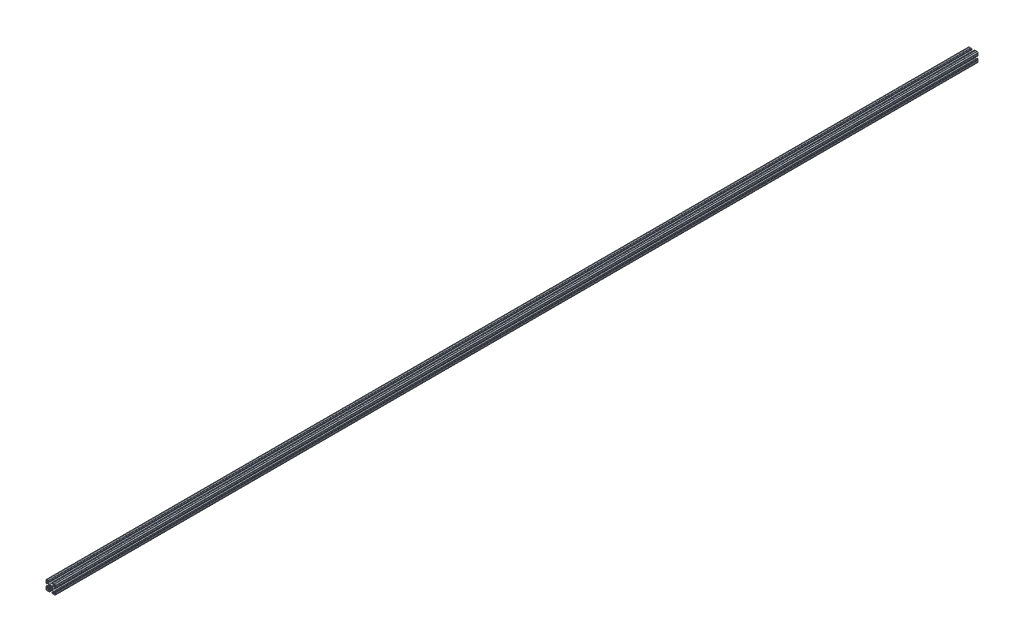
SolidWorks part; units mm, degrees
ref_plane "Front Plane" through (0, 0, 0) normal (0, 0, 1) x (1, 0, 0)
ref_plane "Top Plane" through (0, 0, 0) normal (0, 1, 0) x (1, 0, 0)
ref_plane "Right Plane" through (0, 0, 0) normal (1, 0, 0) x (0, 0, -1)
sketch "Sketch1" plane through (0, 0, 0) normal (0, 0, 1) x (1, 0, 0)
  line L0 (1.5823, 3.1988) -> (3.2921, 4.9085)
  line L1 (3.9207, 5.1689) -> (4.9149, 5.1689)
  line L2 (5.1689, 4.9149) -> (5.1689, 3.9207)
  line L3 (4.9085, 3.2921) -> (3.1988, 1.5823)
  line L4 (3.1988, -1.5823) -> (4.9085, -3.2921)
  line L5 (5.1689, -3.9207) -> (5.1689, -4.9149)
  line L6 (4.9149, -5.1689) -> (3.9207, -5.1689)
  line L7 (3.2921, -4.9085) -> (1.5823, -3.1988)
  line L8 (-1.5823, -3.1988) -> (-3.2921, -4.9085)
  line L9 (-3.9207, -5.1689) -> (-4.9149, -5.1689)
  line L10 (-5.1689, -4.9149) -> (-5.1689, -3.9207)
  line L11 (-4.9085, -3.2921) -> (-3.1988, -1.5823)
  line L12 (-3.1988, 1.5823) -> (-4.9085, 3.2921)
  line L13 (-5.1689, 3.9207) -> (-5.1689, 4.9149)
  line L14 (-4.9149, 5.1689) -> (-3.9207, 5.1689)
  line L15 (-3.2921, 4.9085) -> (-1.5823, 3.1988)
  line L16 (-11.8669, 14.0194) -> (-11.8669, 12.2479)
  line L17 (-12.2479, 11.8669) -> (-14.0195, 11.8669)
  line L18 (-14.0213, 11.8676) -> (-14.5575, 12.4039)
  line L19 (-14.5611, 12.4039) -> (-15.0973, 11.8676)
  line L20 (-15.0991, 11.8669) -> (-16.8707, 11.8669)
  line L21 (-17.2517, 12.2479) -> (-17.2517, 14.4577)
  line L22 (-14.4577, 17.2517) -> (-12.2479, 17.2517)
  line L23 (-11.8669, 16.8707) -> (-11.8669, 15.0991)
  line L24 (-11.8676, 15.0973) -> (-12.4039, 14.5611)
  line L25 (-12.4039, 14.5575) -> (-11.8676, 14.0212)
  line L26 (-14.0194, -11.8669) -> (-12.2479, -11.8669)
  line L27 (-11.8669, -12.2479) -> (-11.8669, -14.0195)
  line L28 (-11.8676, -14.0213) -> (-12.4039, -14.5575)
  line L29 (-12.4039, -14.5611) -> (-11.8676, -15.0973)
  line L30 (-11.8669, -15.0991) -> (-11.8669, -16.8707)
  line L31 (-12.2479, -17.2517) -> (-14.4577, -17.2517)
  line L32 (-17.2517, -14.4577) -> (-17.2517, -12.2479)
  line L33 (-16.8707, -11.8669) -> (-15.0991, -11.8669)
  line L34 (-15.0973, -11.8676) -> (-14.5611, -12.4039)
  line L35 (-14.5575, -12.4039) -> (-14.0212, -11.8676)
  line L36 (11.8669, -14.0194) -> (11.8669, -12.2479)
  line L37 (12.2479, -11.8669) -> (14.0195, -11.8669)
  line L38 (14.0213, -11.8676) -> (14.5575, -12.4039)
  line L39 (14.5611, -12.4039) -> (15.0973, -11.8676)
  line L40 (15.0991, -11.8669) -> (16.8707, -11.8669)
  line L41 (17.2517, -12.2479) -> (17.2517, -14.4577)
  line L42 (14.4577, -17.2517) -> (12.2479, -17.2517)
  line L43 (11.8669, -16.8707) -> (11.8669, -15.0991)
  line L44 (11.8676, -15.0973) -> (12.4039, -14.5611)
  line L45 (12.4039, -14.5575) -> (11.8676, -14.0212)
  line L46 (14.0194, 11.8669) -> (12.2479, 11.8669)
  line L47 (11.8669, 12.2479) -> (11.8669, 14.0195)
  line L48 (11.8676, 14.0213) -> (12.4039, 14.5575)
  line L49 (12.4039, 14.5611) -> (11.8676, 15.0973)
  line L50 (11.8669, 15.0991) -> (11.8669, 16.8707)
  line L51 (12.2479, 17.2517) -> (14.4577, 17.2517)
  line L52 (17.2517, 14.4577) -> (17.2517, 12.2479)
  line L53 (16.8707, 11.8669) -> (15.0991, 11.8669)
  line L54 (15.0973, 11.8676) -> (14.5611, 12.4039)
  line L55 (14.5575, 12.4039) -> (14.0212, 11.8676)
  line L56 (6.3498, -14.9848) -> (5.6531, -14.9848)
  line L57 (4.0778, -16.5601) -> (4.0778, -17.4747)
  line L58 (5.6531, -19.05) -> (7.9756, -19.05)
  line L59 (9.4996, -19.05) -> (14.2981, -19.05)
  line L60 (19.05, -14.3256) -> (19.05, -9.4996)
  line L61 (19.05, -7.9756) -> (19.05, -5.6531)
  line L62 (17.4747, -4.0778) -> (16.5601, -4.0778)
  line L63 (14.9848, -5.6531) -> (14.9848, -6.3498)
  line L64 (15.3661, -6.731) -> (15.6969, -6.731)
  line L65 (16.0782, -7.1122) -> (16.0782, -9.3968)
  line L66 (15.1881, -10.287) -> (12.3526, -10.2871)
  line L67 (11.4535, -9.9142) -> (7.1147, -5.5659)
  line L68 (6.7437, -4.6689) -> (6.7437, 4.6414)
  line L69 (7.1147, 5.5384) -> (11.481, 9.9142)
  line L70 (12.38, 10.2871) -> (15.1881, 10.287)
  line L71 (16.0782, 9.3968) -> (16.0782, 7.1122)
  line L72 (15.6969, 6.731) -> (15.3661, 6.731)
  line L73 (14.9848, 6.3498) -> (14.9848, 5.6531)
  line L74 (16.5601, 4.0778) -> (17.4747, 4.0778)
  line L75 (19.05, 5.6531) -> (19.05, 7.9756)
  line L76 (19.05, 9.4996) -> (19.05, 14.2981)
  line L77 (14.3256, 19.05) -> (9.4996, 19.05)
  line L78 (7.9756, 19.05) -> (5.6531, 19.05)
  line L79 (4.0778, 17.4747) -> (4.0778, 16.5601)
  line L80 (5.6531, 14.9848) -> (6.3498, 14.9848)
  line L81 (6.731, 15.3661) -> (6.731, 15.6969)
  line L82 (7.1122, 16.0782) -> (9.3968, 16.0782)
  line L83 (10.287, 15.1881) -> (10.2871, 12.3526)
  line L84 (9.9142, 11.4535) -> (5.5659, 7.1147)
  line L85 (4.6689, 6.7437) -> (-4.6414, 6.7437)
  line L86 (-5.5384, 7.1147) -> (-9.9142, 11.481)
  line L87 (-10.2871, 12.38) -> (-10.287, 15.1881)
  line L88 (-9.3968, 16.0782) -> (-7.1122, 16.0782)
  line L89 (-6.731, 15.6969) -> (-6.731, 15.3661)
  line L90 (-6.3498, 14.9848) -> (-5.6531, 14.9848)
  line L91 (-4.0778, 16.5601) -> (-4.0778, 17.4747)
  line L92 (-5.6531, 19.05) -> (-7.9756, 19.05)
  line L93 (-9.4996, 19.05) -> (-14.2981, 19.05)
  line L94 (-19.05, 14.3256) -> (-19.05, 9.4996)
  line L95 (-19.05, 7.9756) -> (-19.05, 5.6531)
  line L96 (-17.4747, 4.0778) -> (-16.5601, 4.0778)
  line L97 (-14.9848, 5.6531) -> (-14.9848, 6.3498)
  line L98 (-15.3661, 6.731) -> (-15.6969, 6.731)
  line L99 (-16.0782, 7.1122) -> (-16.0782, 9.3968)
  line L100 (-15.1881, 10.287) -> (-12.3526, 10.2871)
  line L101 (-11.4535, 9.9142) -> (-7.1147, 5.5659)
  line L102 (-6.7437, 4.6689) -> (-6.7437, -4.6414)
  line L103 (-7.1147, -5.5384) -> (-11.481, -9.9142)
  line L104 (-12.38, -10.2871) -> (-15.1881, -10.287)
  line L105 (-16.0782, -9.3968) -> (-16.0782, -7.1122)
  line L106 (-15.6969, -6.731) -> (-15.3661, -6.731)
  line L107 (-14.9848, -6.3498) -> (-14.9848, -5.6531)
  line L108 (-16.5601, -4.0778) -> (-17.4747, -4.0778)
  line L109 (-19.05, -5.6531) -> (-19.05, -7.9756)
  line L110 (-19.05, -9.4996) -> (-19.05, -14.2981)
  line L111 (-14.3256, -19.05) -> (-9.4996, -19.05)
  line L112 (-7.9756, -19.05) -> (-5.6531, -19.05)
  line L113 (-4.0778, -17.4747) -> (-4.0778, -16.5601)
  line L114 (-5.6531, -14.9848) -> (-6.3498, -14.9848)
  line L115 (-6.731, -15.3661) -> (-6.731, -15.6969)
  line L116 (-7.1122, -16.0782) -> (-9.3968, -16.0782)
  line L117 (-10.287, -15.1881) -> (-10.2871, -12.3526)
  line L118 (-9.9142, -11.4535) -> (-5.5659, -7.1147)
  line L119 (-4.6689, -6.7437) -> (4.6414, -6.7437)
  line L120 (5.5384, -7.1147) -> (9.9142, -11.481)
  line L121 (10.2871, -12.38) -> (10.287, -15.1881)
  line L122 (9.3968, -16.0782) -> (7.1122, -16.0782)
  line L123 (6.731, -15.6969) -> (6.731, -15.3661)
  arc A0 (1.178, 3.1119) -> (1.5823, 3.1988) centre (1.3129, 3.4682) ccw
  arc A1 (3.9207, 5.1689) -> (3.2921, 4.9085) centre (3.9207, 4.2799) ccw
  arc A2 (5.1689, 4.9149) -> (4.9149, 5.1689) centre (4.9149, 4.9149) ccw
  arc A3 (4.9085, 3.2921) -> (5.1689, 3.9207) centre (4.2799, 3.9207) ccw
  arc A4 (3.1988, 1.5823) -> (3.1119, 1.178) centre (3.4682, 1.3129) ccw
  arc A5 (3.1119, -1.178) -> (3.1119, 1.178) centre (0, 0) ccw
  arc A6 (3.1119, -1.178) -> (3.1988, -1.5823) centre (3.4682, -1.3129) ccw
  arc A7 (5.1689, -3.9207) -> (4.9085, -3.2921) centre (4.2799, -3.9207) ccw
  arc A8 (4.9149, -5.1689) -> (5.1689, -4.9149) centre (4.9149, -4.9149) ccw
  arc A9 (3.2921, -4.9085) -> (3.9207, -5.1689) centre (3.9207, -4.2799) ccw
  arc A10 (1.5823, -3.1988) -> (1.178, -3.1119) centre (1.3129, -3.4682) ccw
  arc A11 (-1.178, -3.1119) -> (1.178, -3.1119) centre (0, 0) ccw
  arc A12 (-1.178, -3.1119) -> (-1.5823, -3.1988) centre (-1.3129, -3.4682) ccw
  arc A13 (-3.9207, -5.1689) -> (-3.2921, -4.9085) centre (-3.9207, -4.2799) ccw
  arc A14 (-5.1689, -4.9149) -> (-4.9149, -5.1689) centre (-4.9149, -4.9149) ccw
  arc A15 (-4.9085, -3.2921) -> (-5.1689, -3.9207) centre (-4.2799, -3.9207) ccw
  arc A16 (-3.1988, -1.5823) -> (-3.1119, -1.178) centre (-3.4682, -1.3129) ccw
  arc A17 (-3.1119, 1.178) -> (-3.1119, -1.178) centre (0, 0) ccw
  arc A18 (-3.1119, 1.178) -> (-3.1988, 1.5823) centre (-3.4682, 1.3129) ccw
  arc A19 (-5.1689, 3.9207) -> (-4.9085, 3.2921) centre (-4.2799, 3.9207) ccw
  arc A20 (-4.9149, 5.1689) -> (-5.1689, 4.9149) centre (-4.9149, 4.9149) ccw
  arc A21 (-3.2921, 4.9085) -> (-3.9207, 5.1689) centre (-3.9207, 4.2799) ccw
  arc A22 (-1.5823, 3.1988) -> (-1.178, 3.1119) centre (-1.3129, 3.4682) ccw
  arc A23 (1.178, 3.1119) -> (-1.178, 3.1119) centre (0, 0) ccw
  arc A24 (-11.8669, 14.0194) -> (-11.8676, 14.0212) centre (-11.8694, 14.0194) ccw
  arc A25 (-12.2479, 11.8669) -> (-11.8669, 12.2479) centre (-12.2479, 12.2479) ccw
  arc A26 (-14.0213, 11.8676) -> (-14.0195, 11.8669) centre (-14.0195, 11.8694) ccw
  arc A27 (-14.5575, 12.4039) -> (-14.5611, 12.4039) centre (-14.5593, 12.4021) ccw
  arc A28 (-15.0991, 11.8669) -> (-15.0973, 11.8676) centre (-15.0991, 11.8694) ccw
  arc A29 (-17.2517, 12.2479) -> (-16.8707, 11.8669) centre (-16.8707, 12.2479) ccw
  arc A30 (-14.4577, 17.2517) -> (-17.2517, 14.4577) centre (-14.4577, 14.4577) ccw
  arc A31 (-11.8669, 16.8707) -> (-12.2479, 17.2517) centre (-12.2479, 16.8707) ccw
  arc A32 (-11.8676, 15.0973) -> (-11.8669, 15.0991) centre (-11.8694, 15.0991) ccw
  arc A33 (-12.4039, 14.5611) -> (-12.4039, 14.5575) centre (-12.4021, 14.5593) ccw
  arc A34 (-14.0194, -11.8669) -> (-14.0212, -11.8676) centre (-14.0194, -11.8694) ccw
  arc A35 (-11.8669, -12.2479) -> (-12.2479, -11.8669) centre (-12.2479, -12.2479) ccw
  arc A36 (-11.8676, -14.0213) -> (-11.8669, -14.0195) centre (-11.8694, -14.0195) ccw
  arc A37 (-12.4039, -14.5575) -> (-12.4039, -14.5611) centre (-12.4021, -14.5593) ccw
  arc A38 (-11.8669, -15.0991) -> (-11.8676, -15.0973) centre (-11.8694, -15.0991) ccw
  arc A39 (-12.2479, -17.2517) -> (-11.8669, -16.8707) centre (-12.2479, -16.8707) ccw
  arc A40 (-17.2517, -14.4577) -> (-14.4577, -17.2517) centre (-14.4577, -14.4577) ccw
  arc A41 (-16.8707, -11.8669) -> (-17.2517, -12.2479) centre (-16.8707, -12.2479) ccw
  arc A42 (-15.0973, -11.8676) -> (-15.0991, -11.8669) centre (-15.0991, -11.8694) ccw
  arc A43 (-14.5611, -12.4039) -> (-14.5575, -12.4039) centre (-14.5593, -12.4021) ccw
  arc A44 (11.8669, -14.0194) -> (11.8676, -14.0212) centre (11.8694, -14.0194) ccw
  arc A45 (12.2479, -11.8669) -> (11.8669, -12.2479) centre (12.2479, -12.2479) ccw
  arc A46 (14.0213, -11.8676) -> (14.0195, -11.8669) centre (14.0195, -11.8694) ccw
  arc A47 (14.5575, -12.4039) -> (14.5611, -12.4039) centre (14.5593, -12.4021) ccw
  arc A48 (15.0991, -11.8669) -> (15.0973, -11.8676) centre (15.0991, -11.8694) ccw
  arc A49 (17.2517, -12.2479) -> (16.8707, -11.8669) centre (16.8707, -12.2479) ccw
  arc A50 (14.4577, -17.2517) -> (17.2517, -14.4577) centre (14.4577, -14.4577) ccw
  arc A51 (11.8669, -16.8707) -> (12.2479, -17.2517) centre (12.2479, -16.8707) ccw
  arc A52 (11.8676, -15.0973) -> (11.8669, -15.0991) centre (11.8694, -15.0991) ccw
  arc A53 (12.4039, -14.5611) -> (12.4039, -14.5575) centre (12.4021, -14.5593) ccw
  arc A54 (14.0194, 11.8669) -> (14.0212, 11.8676) centre (14.0194, 11.8694) ccw
  arc A55 (11.8669, 12.2479) -> (12.2479, 11.8669) centre (12.2479, 12.2479) ccw
  arc A56 (11.8676, 14.0213) -> (11.8669, 14.0195) centre (11.8694, 14.0195) ccw
  arc A57 (12.4039, 14.5575) -> (12.4039, 14.5611) centre (12.4021, 14.5593) ccw
  arc A58 (11.8669, 15.0991) -> (11.8676, 15.0973) centre (11.8694, 15.0991) ccw
  arc A59 (12.2479, 17.2517) -> (11.8669, 16.8707) centre (12.2479, 16.8707) ccw
  arc A60 (17.2517, 14.4577) -> (14.4577, 17.2517) centre (14.4577, 14.4577) ccw
  arc A61 (16.8707, 11.8669) -> (17.2517, 12.2479) centre (16.8707, 12.2479) ccw
  arc A62 (15.0973, 11.8676) -> (15.0991, 11.8669) centre (15.0991, 11.8694) ccw
  arc A63 (14.5611, 12.4039) -> (14.5575, 12.4039) centre (14.5593, 12.4021) ccw
  arc A64 (6.731, -15.3661) -> (6.3498, -14.9848) centre (6.35, -15.3658) ccw
  arc A65 (5.6531, -14.9848) -> (4.0778, -16.5601) centre (5.6526, -16.5596) ccw
  arc A66 (4.0778, -17.4747) -> (5.6531, -19.05) centre (5.6526, -17.4752) ccw
  arc A67 (9.4996, -19.05) -> (7.9756, -19.05) centre (8.7376, -19.05) ccw
  arc A68 (15.8221, -19.0496) -> (14.2981, -19.05) centre (15.0601, -19.05) ccw
  arc A69 (15.8221, -19.0496) -> (19.0499, -15.8496) centre (15.875, -15.875) ccw
  arc A70 (19.05, -14.3256) -> (19.0499, -15.8496) centre (19.05, -15.0876) ccw
  arc A71 (19.05, -7.9756) -> (19.05, -9.4996) centre (19.05, -8.7376) ccw
  arc A72 (19.05, -5.6531) -> (17.4747, -4.0778) centre (17.4752, -5.6526) ccw
  arc A73 (16.5601, -4.0778) -> (14.9848, -5.6531) centre (16.5596, -5.6526) ccw
  arc A74 (14.9848, -6.3498) -> (15.3661, -6.731) centre (15.3658, -6.35) ccw
  arc A75 (16.0782, -7.1122) -> (15.6969, -6.731) centre (15.6972, -7.112) ccw
  arc A76 (15.1881, -10.287) -> (16.0782, -9.3968) centre (15.1892, -9.398) ccw
  arc A77 (11.4535, -9.9142) -> (12.3526, -10.2871) centre (12.3525, -9.0171) ccw
  arc A78 (6.7437, -4.6689) -> (7.1147, -5.5659) centre (8.0137, -4.6689) ccw
  arc A79 (7.1147, 5.5384) -> (6.7437, 4.6414) centre (8.0137, 4.6414) ccw
  arc A80 (12.38, 10.2871) -> (11.481, 9.9142) centre (12.38, 9.0171) ccw
  arc A81 (16.0782, 9.3968) -> (15.1881, 10.287) centre (15.1892, 9.398) ccw
  arc A82 (15.6969, 6.731) -> (16.0782, 7.1122) centre (15.6972, 7.112) ccw
  arc A83 (15.3661, 6.731) -> (14.9848, 6.3498) centre (15.3658, 6.35) ccw
  arc A84 (14.9848, 5.6531) -> (16.5601, 4.0778) centre (16.5596, 5.6526) ccw
  arc A85 (17.4747, 4.0778) -> (19.05, 5.6531) centre (17.4752, 5.6526) ccw
  arc A86 (19.05, 9.4996) -> (19.05, 7.9756) centre (19.05, 8.7376) ccw
  arc A87 (19.0496, 15.8221) -> (19.05, 14.2981) centre (19.05, 15.0601) ccw
  arc A88 (19.0496, 15.8221) -> (15.8496, 19.0499) centre (15.875, 15.875) ccw
  arc A89 (14.3256, 19.05) -> (15.8496, 19.0499) centre (15.0876, 19.05) ccw
  arc A90 (7.9756, 19.05) -> (9.4996, 19.05) centre (8.7376, 19.05) ccw
  arc A91 (5.6531, 19.05) -> (4.0778, 17.4747) centre (5.6526, 17.4752) ccw
  arc A92 (4.0778, 16.5601) -> (5.6531, 14.9848) centre (5.6526, 16.5596) ccw
  arc A93 (6.3498, 14.9848) -> (6.731, 15.3661) centre (6.35, 15.3658) ccw
  arc A94 (7.1122, 16.0782) -> (6.731, 15.6969) centre (7.112, 15.6972) ccw
  arc A95 (10.287, 15.1881) -> (9.3968, 16.0782) centre (9.398, 15.1892) ccw
  arc A96 (9.9142, 11.4535) -> (10.2871, 12.3526) centre (9.0171, 12.3525) ccw
  arc A97 (4.6689, 6.7437) -> (5.5659, 7.1147) centre (4.6689, 8.0137) ccw
  arc A98 (-5.5384, 7.1147) -> (-4.6414, 6.7437) centre (-4.6414, 8.0137) ccw
  arc A99 (-10.2871, 12.38) -> (-9.9142, 11.481) centre (-9.0171, 12.38) ccw
  arc A100 (-9.3968, 16.0782) -> (-10.287, 15.1881) centre (-9.398, 15.1892) ccw
  arc A101 (-6.731, 15.6969) -> (-7.1122, 16.0782) centre (-7.112, 15.6972) ccw
  arc A102 (-6.731, 15.3661) -> (-6.3498, 14.9848) centre (-6.35, 15.3658) ccw
  arc A103 (-5.6531, 14.9848) -> (-4.0778, 16.5601) centre (-5.6526, 16.5596) ccw
  arc A104 (-4.0778, 17.4747) -> (-5.6531, 19.05) centre (-5.6526, 17.4752) ccw
  arc A105 (-9.4996, 19.05) -> (-7.9756, 19.05) centre (-8.7376, 19.05) ccw
  arc A106 (-15.8221, 19.0496) -> (-14.2981, 19.05) centre (-15.0601, 19.05) ccw
  arc A107 (-15.8221, 19.0496) -> (-19.0499, 15.8496) centre (-15.875, 15.875) ccw
  arc A108 (-19.05, 14.3256) -> (-19.0499, 15.8496) centre (-19.05, 15.0876) ccw
  arc A109 (-19.05, 7.9756) -> (-19.05, 9.4996) centre (-19.05, 8.7376) ccw
  arc A110 (-19.05, 5.6531) -> (-17.4747, 4.0778) centre (-17.4752, 5.6526) ccw
  arc A111 (-16.5601, 4.0778) -> (-14.9848, 5.6531) centre (-16.5596, 5.6526) ccw
  arc A112 (-14.9848, 6.3498) -> (-15.3661, 6.731) centre (-15.3658, 6.35) ccw
  arc A113 (-16.0782, 7.1122) -> (-15.6969, 6.731) centre (-15.6972, 7.112) ccw
  arc A114 (-15.1881, 10.287) -> (-16.0782, 9.3968) centre (-15.1892, 9.398) ccw
  arc A115 (-11.4535, 9.9142) -> (-12.3526, 10.2871) centre (-12.3525, 9.0171) ccw
  arc A116 (-6.7437, 4.6689) -> (-7.1147, 5.5659) centre (-8.0137, 4.6689) ccw
  arc A117 (-7.1147, -5.5384) -> (-6.7437, -4.6414) centre (-8.0137, -4.6414) ccw
  arc A118 (-12.38, -10.2871) -> (-11.481, -9.9142) centre (-12.38, -9.0171) ccw
  arc A119 (-16.0782, -9.3968) -> (-15.1881, -10.287) centre (-15.1892, -9.398) ccw
  arc A120 (-15.6969, -6.731) -> (-16.0782, -7.1122) centre (-15.6972, -7.112) ccw
  arc A121 (-15.3661, -6.731) -> (-14.9848, -6.3498) centre (-15.3658, -6.35) ccw
  arc A122 (-14.9848, -5.6531) -> (-16.5601, -4.0778) centre (-16.5596, -5.6526) ccw
  arc A123 (-17.4747, -4.0778) -> (-19.05, -5.6531) centre (-17.4752, -5.6526) ccw
  arc A124 (-19.05, -9.4996) -> (-19.05, -7.9756) centre (-19.05, -8.7376) ccw
  arc A125 (-19.0496, -15.8221) -> (-19.05, -14.2981) centre (-19.05, -15.0601) ccw
  arc A126 (-19.0496, -15.8221) -> (-15.8496, -19.0499) centre (-15.875, -15.875) ccw
  arc A127 (-14.3256, -19.05) -> (-15.8496, -19.0499) centre (-15.0876, -19.05) ccw
  arc A128 (-7.9756, -19.05) -> (-9.4996, -19.05) centre (-8.7376, -19.05) ccw
  arc A129 (-5.6531, -19.05) -> (-4.0778, -17.4747) centre (-5.6526, -17.4752) ccw
  arc A130 (-4.0778, -16.5601) -> (-5.6531, -14.9848) centre (-5.6526, -16.5596) ccw
  arc A131 (-6.3498, -14.9848) -> (-6.731, -15.3661) centre (-6.35, -15.3658) ccw
  arc A132 (-7.1122, -16.0782) -> (-6.731, -15.6969) centre (-7.112, -15.6972) ccw
  arc A133 (-10.287, -15.1881) -> (-9.3968, -16.0782) centre (-9.398, -15.1892) ccw
  arc A134 (-9.9142, -11.4535) -> (-10.2871, -12.3526) centre (-9.0171, -12.3525) ccw
  arc A135 (-4.6689, -6.7437) -> (-5.5659, -7.1147) centre (-4.6689, -8.0137) ccw
  arc A136 (5.5384, -7.1147) -> (4.6414, -6.7437) centre (4.6414, -8.0137) ccw
  arc A137 (10.2871, -12.38) -> (9.9142, -11.481) centre (9.0171, -12.38) ccw
  arc A138 (9.3968, -16.0782) -> (10.287, -15.1881) centre (9.398, -15.1892) ccw
  arc A139 (6.731, -15.6969) -> (7.1122, -16.0782) centre (7.112, -15.6972) ccw
extrude "Extrude1" add sketch "Sketch1" against normal blind 3683
